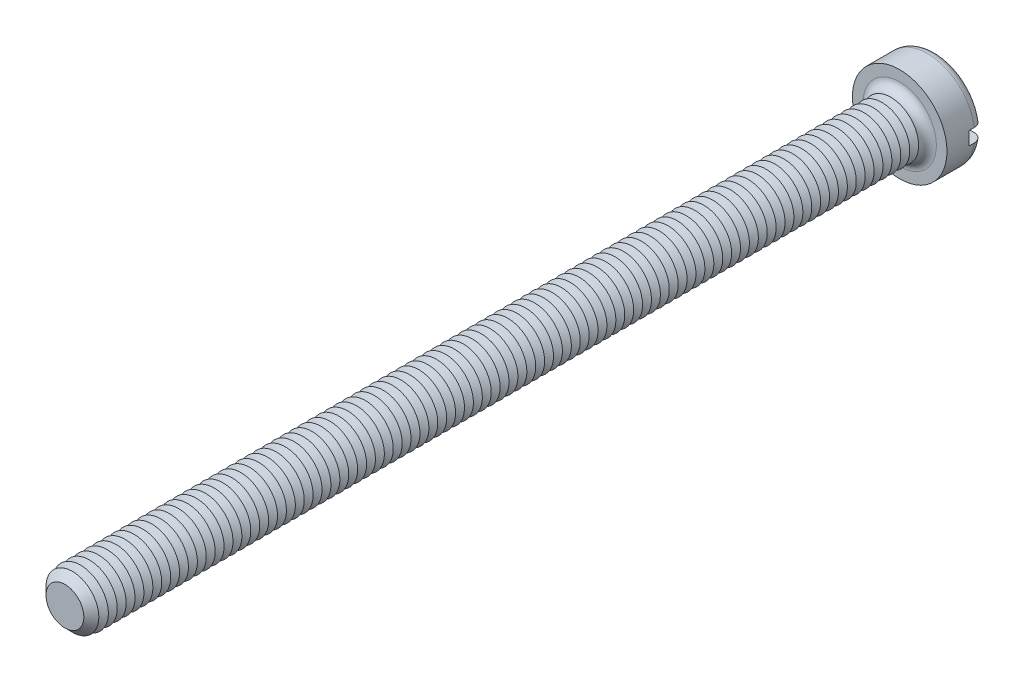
SolidWorks part; units mm, degrees
ref_plane "Front Plane" through (0, 0, 0) normal (0, 0, 1) x (1, 0, 0)
ref_plane "Top Plane" through (0, 0, 0) normal (0, 1, 0) x (1, 0, 0)
ref_plane "Right Plane" through (0, 0, 0) normal (1, 0, 0) x (0, 0, -1)
sketch "Sketch3" plane through (0, 0, 0) normal (0, 0, 1) x (1, 0, 0)
  circle A0 centre (0, 0) radius 4.25
  dimension "D1" = 8.5
extrude "Boss-Extrude2" add sketch "Sketch3" against normal blind 3.3
sketch "Sketch4" plane through (0, 0, 0) normal (0, 0, 1) x (1, 0, 0)
  circle A0 centre (0, 0) radius 2.5
  dimension "D1" = 5
extrude "Boss-Extrude3" add sketch "Sketch4" along normal blind 75
fillet "Fillet1" radius 0.8 2 edges at (4.25, 0, -3.3) (2.5, 0, 0)
chamfer "Chamfer1" distance 0.8 angle 45 1 edges at (2.5, 0, 75)
sketch "Sketch5" plane through (0, 0, 0) normal (1, 0, 0) x (0, 0, -1)
  line L0 (1.6944, 0) -> (-7.6738, 0) construction
sketch "Sketch6" plane through (0, 0, 0) normal (1, 0, 0) x (0, 0, -1)
  line L0 (-0.8, 2.5) -> (-1.2, 1.8072)
  line L1 (-1.2, 1.8072) -> (-1.6, 2.5)
  line L2 (-0.8, 2.5) -> (-74.2, 2.5) construction
  line L3 (-1.6, 2.5) -> (-0.8, 2.5)
  dimension "D1" = 0.8
revolve "Cut-Revolve1" cut sketch "Sketch6" angle 360 about L0
pattern_linear "LPattern1" count 92 spacing 0.8 along (0, 0, 1) of "Cut-Revolve1"
sketch "Sketch8" plane through (0, 0, -3.3) normal (0, 0, -1) x (-1, 0, 0)
  line L1 (4.25, -0.6) -> (-4.25, -0.6)
  line L2 (4.25, -0.6) -> (4.25, 0.6)
  line L3 (4.25, 0.6) -> (-4.25, 0.6)
  line L4 (-4.25, -0.6) -> (-4.25, 0.6)
  line L5 (4.25, -0.6) -> (-4.25, 0.6) construction
  line L6 (4.25, 0.6) -> (-4.25, -0.6) construction
  point P0 (0, 0)
  dimension "D1" = 8.5
  dimension "D2" = 1.2
extrude "Cut-Extrude1" cut sketch "Sketch8" against normal blind 1.3
